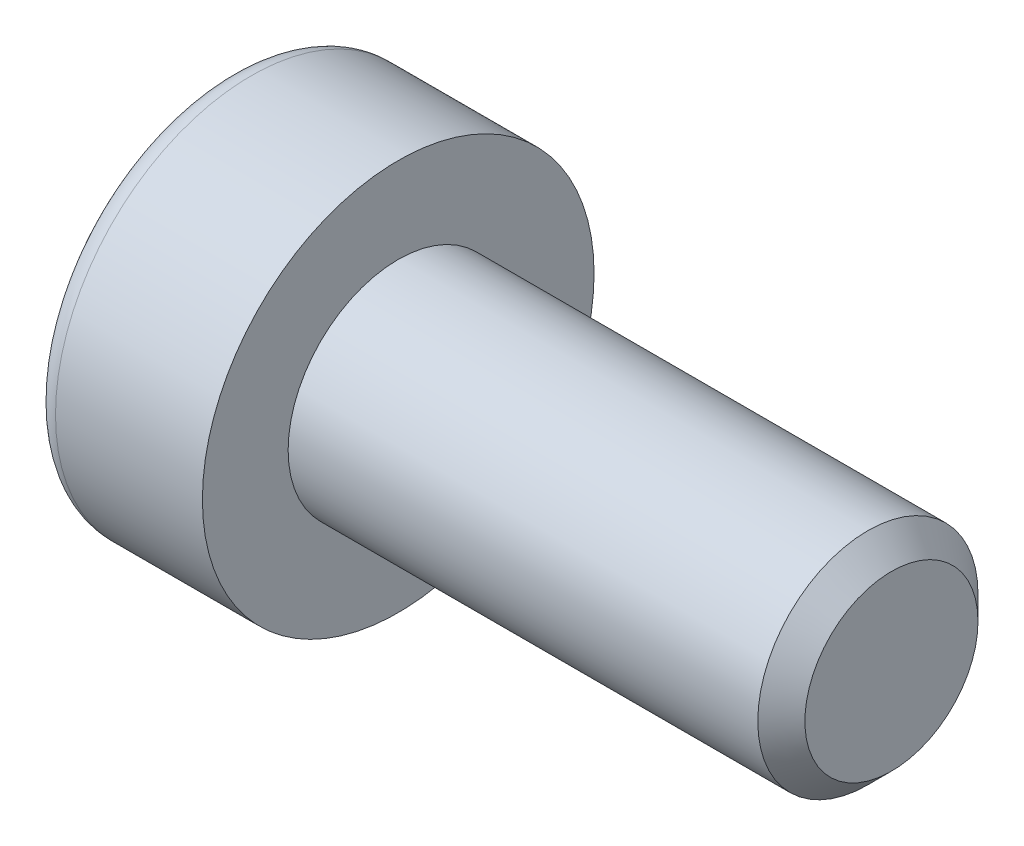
SolidWorks part; units mm, degrees
ref_plane "Plan de face" through (0, 0, 0) normal (0, 0, 1) x (1, 0, 0)
ref_plane "Plan de dessus" through (0, 0, 0) normal (0, 1, 0) x (1, 0, 0)
ref_plane "Plan de droite" through (0, 0, 0) normal (1, 0, 0) x (0, 0, -1)
sketch "Esquisse1" plane through (0, 0, 0) normal (0, 0, 1) x (1, 0, 0)
  line L0 (-324.2724, -82.2333) -> (-338.6952, -82.2333) construction
  line L2 (-324.2724, -82.2333) -> (-324.2724, -80.3507)
  line L3 (-324.2724, -80.3507) -> (-324.7848, -79.8384)
  line L5 (-324.7848, -79.8384) -> (-335, -79.8384)
  line L8 (-335, -79.8384) -> (-335, -77.9737)
  line L9 (-335, -77.9737) -> (-338.6952, -77.9737)
  line L10 (-338.6952, -77.9737) -> (-338.6952, -82.2333)
  line L11 (-324.2724, -82.2333) -> (-338.6952, -82.2333)
  dimension "D1" = 2.3949
  dimension "D2" = 10.7276
revolve "Révolution2" add sketch "Esquisse1" angle 360 about L0
sketch "Esquisse2" plane through (-338.6952, 0, 0) normal (-1, 0, 0) x (0, 0, 1)
  line L1 (-0.3371, -79.8295) -> (-2.2503, -81.3233)
  line L2 (-2.2503, -81.3233) -> (-1.9132, -83.7271)
  line L3 (-1.9132, -83.7271) -> (0.3371, -84.6371)
  line L4 (0.3371, -84.6371) -> (2.2503, -83.1432)
  line L5 (2.2503, -83.1432) -> (1.9132, -80.7394)
  line L6 (1.9132, -80.7394) -> (-0.3371, -79.8295)
  circle A0 centre (0, -82.2333) radius 2.1021 construction
extrude "Enlèv. mat.-Extru.1" cut sketch "Esquisse2" against normal blind 2
fillet "Congé1" radius 0.5 1 edges at (-338.6952, -82.2333, -4.2595)
